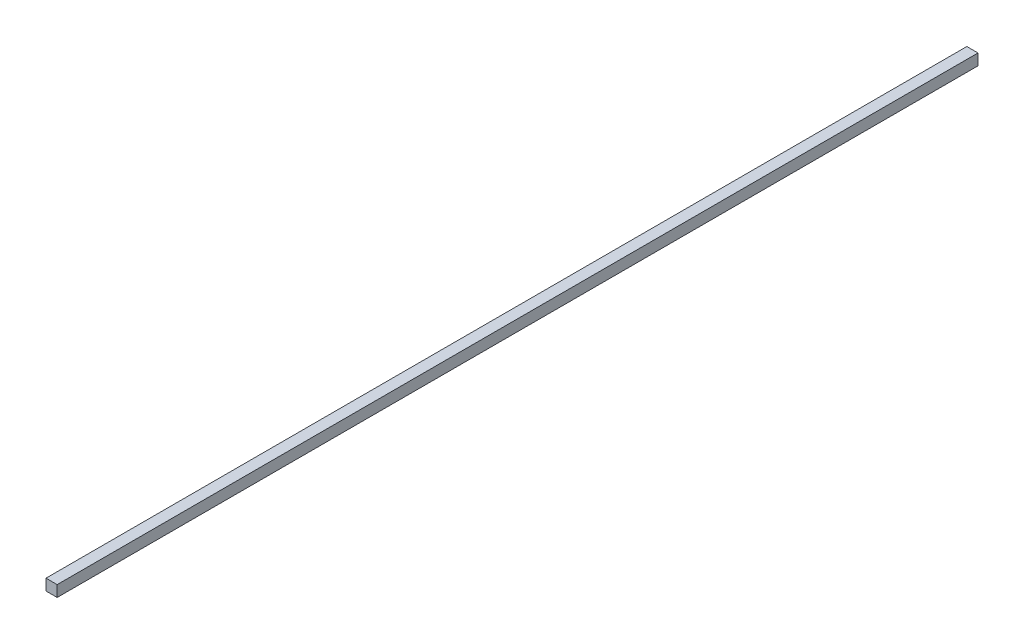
SolidWorks part; units mm, degrees
ref_plane "Plan de face" through (0, 0, 0) normal (0, 0, 1) x (1, 0, 0)
ref_plane "Plan de dessus" through (0, 0, 0) normal (0, 1, 0) x (1, 0, 0)
ref_plane "Plan de droite" through (0, 0, 0) normal (1, 0, 0) x (0, 0, -1)
sketch "Esquisse1" plane through (0, 0, 0) normal (0, 0, 1) x (1, 0, 0)
  line L1 (-1, 1) -> (1, 1)
  line L2 (-1, 1) -> (-1, -1)
  line L3 (-1, -1) -> (1, -1)
  line L4 (1, 1) -> (1, -1)
  point P4 (0, 1)
  point P5 (-1, 0)
  dimension "D1" = 2
  dimension "D2" = 2
extrude "Extrusion1" add sketch "Esquisse1" along normal mid plane 165
